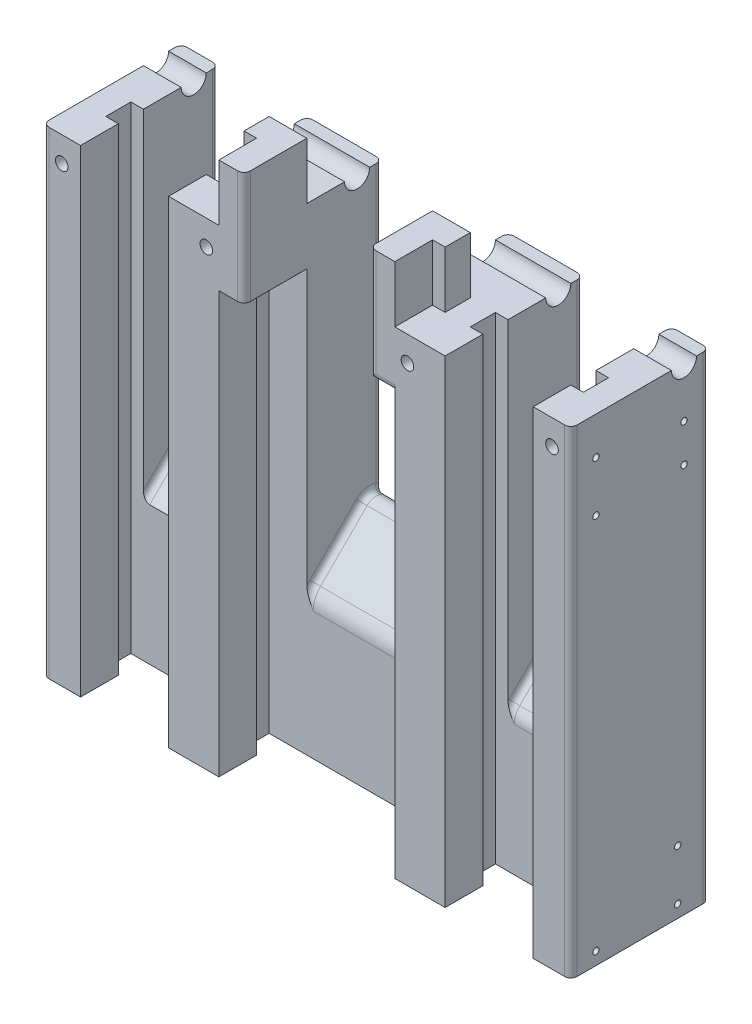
SolidWorks part; units mm, degrees
ref_plane "Front Plane" through (0, 0, 0) normal (0, 0, 1) x (1, 0, 0)
ref_plane "Top Plane" through (0, 0, 0) normal (0, 1, 0) x (1, 0, 0)
ref_plane "Right Plane" through (0, 0, 0) normal (1, 0, 0) x (0, 0, -1)
sketch "Sketch1" plane through (0, 0, 0) normal (0, 0, 1) x (1, 0, 0)
  line L5 (533.4, 406.4) -> (0, 406.4)
  line L7 (533.4, 406.4) -> (533.4, 533.4)
  line L8 (533.4, 533.4) -> (0, 533.4)
  line L9 (0, 406.4) -> (0, 533.4)
  line L10 (0, 406.4) -> (0, 0)
  line L16 (533.4, 406.4) -> (533.4, 0)
  line L17 (533.4, 406.4) -> (0, 533.4) construction
  line L18 (533.4, 0) -> (0, 0)
  line L19 (533.4, 533.4) -> (0, 406.4) construction
  line L24 (0, 406.4) -> (533.4, 406.4)
  point P2 (266.7, 469.9)
  dimension "D1" = 406.4
  dimension "D2" = 533.4
  dimension "D3" = 127
extrude "Boss-Extrude1" add sketch "Sketch1" along normal blind 139.7 contours L24 L10 L18 L16 | L9 L5 L7 L8
sketch "Sketch3" plane through (0, 533.4, 0) normal (0, 1, 0) x (1, 0, 0)
  line L0 (127, -101.6) -> (139.7, -101.6)
  line L1 (406.4, -101.6) -> (393.7, -101.6)
  line L2 (0, -139.7) -> (0, 0) construction
  line L3 (355.6, -101.6) -> (368.3, -101.6)
  line L6 (355.6, -155.448) -> (177.8, -155.448)
  line L8 (533.4, 0) -> (0, 0) construction
  line L10 (495.3, -155.448) -> (406.4, -155.448)
  line L11 (495.3, -155.448) -> (495.3, -101.6)
  line L13 (406.4, -155.448) -> (406.4, -101.6)
  line L15 (38.1, -155.448) -> (127, -155.448)
  line L16 (38.1, -155.448) -> (38.1, -101.6)
  line L17 (127, -155.448) -> (127, -101.6)
  line L18 (533.4, -76.2) -> (0, -76.2) construction
  line L23 (139.7, -76.2) -> (139.7, -101.6)
  line L24 (508, -76.2) -> (393.7, -76.2)
  line L25 (508, -76.2) -> (508, -101.6)
  line L26 (508, -101.6) -> (495.3, -101.6)
  line L27 (393.7, -76.2) -> (393.7, -101.6)
  line L28 (266.7, -76.2) -> (266.7, 0) construction
  line L29 (177.8, -101.6) -> (177.8, -155.448)
  line L30 (165.1, -76.2) -> (368.3, -76.2)
  line L31 (165.1, -76.2) -> (165.1, -101.6)
  line L32 (165.1, -101.6) -> (177.8, -101.6)
  line L33 (368.3, -76.2) -> (368.3, -101.6)
  line L36 (25.4, -101.6) -> (38.1, -101.6)
  line L37 (25.4, -76.2) -> (25.4, -101.6)
  line L38 (25.4, -76.2) -> (139.7, -76.2)
  line L39 (355.6, -101.6) -> (355.6, -155.448)
  dimension "D1" = 25.4
  dimension "D2" = 38.1
  dimension "D3" = 127
  dimension "D4" = 165.1
  dimension "D5" = 266.7
  dimension "D6" = 393.7
  dimension "D7" = 76.2
  dimension "D8" = 101.6
  dimension "D9" = 155.448
extrude "Cut-Extrude1" cut sketch "Sketch3" against normal through all both and the other way through all
sketch "Sketch4" plane through (0, 533.4, 0) normal (0, 1, 0) x (1, 0, 0)
  line L0 (266.7, -104.648) -> (266.7, 0)
  line L3 (127, -101.6) -> (127, -139.7) construction
  line L4 (177.8, -139.7) -> (127, -139.7) construction
  line L5 (203.2, -104.648) -> (330.2, -104.648)
  line L6 (203.2, -104.648) -> (203.2, 0)
  line L7 (203.2, 0) -> (330.2, 0)
  line L8 (330.2, -104.648) -> (330.2, 0)
  line L9 (203.2, -104.648) -> (330.2, 0) construction
  line L10 (203.2, 0) -> (330.2, -104.648) construction
  point P8 (266.7, -52.324)
  dimension "D1" = 76.2
  dimension "D2" = 139.7
  dimension "D3" = 35.052
  dimension "D4" = 87.376
extrude "Cut-Extrude2" cut sketch "Sketch4" against normal blind 292.1
sketch "Sketch5" plane through (0, 533.4, 0) normal (0, 1, 0) x (1, 0, 0)
  line L0 (82.55, -101.6) -> (82.55, 0)
  line L3 (266.7, 0) -> (266.7, -76.2)
  line L4 (38.1, -101.6) -> (127, -101.6)
  line L5 (38.1, -101.6) -> (38.1, 0)
  line L6 (38.1, 0) -> (127, 0)
  line L7 (127, -101.6) -> (127, 0)
  line L8 (38.1, -101.6) -> (127, 0) construction
  line L9 (38.1, 0) -> (127, -101.6) construction
  line L12 (495.3, 0) -> (406.4, -101.6) construction
  line L13 (495.3, -101.6) -> (406.4, 0) construction
  line L14 (406.4, -101.6) -> (406.4, 0)
  line L15 (495.3, 0) -> (406.4, 0)
  line L16 (495.3, -101.6) -> (495.3, 0)
  line L17 (495.3, -101.6) -> (406.4, -101.6)
  line L18 (450.85, -101.6) -> (450.85, 0)
  line L19 (406.4, -139.7) -> (406.4, -101.6) construction
  line L20 (406.4, -139.7) -> (406.4, -101.6) construction
  point P6 (82.55, -50.8)
  point P23 (450.85, -50.8)
  dimension "D1" = 82.55
  dimension "D2" = 127
  dimension "D4" = 266.7
  dimension "D5" = 50.8
  dimension "D6" = 76.2
extrude "Cut-Extrude3" cut sketch "Sketch5" against normal blind 292.1
sketch "Sketch7" plane through (533.4, 0, 0) normal (1, 0, 0) x (0, 0, -1)
  line L3 (0, 533.4) -> (0, 0) construction
  line L4 (-139.7, 533.4) -> (0, 533.4) construction
  circle A0 centre (-25.4, 508) radius 12.7
  dimension "D1" = 25.4
  dimension "D2" = 25.4
  dimension "D3" = 25.4
extrude "Cut-Extrude4" cut sketch "Sketch7" against normal through all
chamfer "Chamfer1" distance 76.2 angle 45 3 edges at (82.55, 241.3, 76.2) (450.85, 241.3, 76.2) (266.7, 241.3, 76.2)
fillet "Fillet1" radius 12.7 3 edges at (82.55, 241.3, 0) (266.7, 241.3, 0) (450.85, 241.3, 0)
fillet "Fillet2" radius 19.05 1 edges at (450.85, 165.1, 76.2)
fillet "Fillet3" radius 25.4 1 edges at (266.7, 165.1, 76.2)
sketch "Sketch8" plane through (0, 533.4, 0) normal (0, 1, 0) x (1, 0, 0)
  line L0 (533.4, 0) -> (495.3, 0) construction
  line L1 (495.3, 0) -> (495.3, -76.2) construction
  line L2 (495.3, -76.2) -> (508, -76.2) construction
  line L3 (508, -76.2) -> (508, -101.6) construction
  line L4 (508, -101.6) -> (495.3, -101.6) construction
  line L5 (495.3, -101.6) -> (495.3, -139.7) construction
  line L6 (495.3, -139.7) -> (533.4, -139.7) construction
  line L7 (533.4, -139.7) -> (533.4, 0) construction
  line L8 (38.1, -76.2) -> (38.1, 0) construction
  line L9 (38.1, 0) -> (0, 0) construction
  line L10 (0, 0) -> (0, -139.7) construction
  line L11 (0, -139.7) -> (38.1, -139.7) construction
  line L12 (38.1, -139.7) -> (38.1, -101.6) construction
  line L13 (38.1, -101.6) -> (25.4, -101.6) construction
  line L14 (25.4, -101.6) -> (25.4, -76.2) construction
  line L15 (25.4, -76.2) -> (38.1, -76.2) construction
  line L16 (203.2, 0) -> (127, 0) construction
  line L17 (127, 0) -> (127, -76.2) construction
  line L18 (127, -76.2) -> (139.7, -76.2) construction
  line L19 (139.7, -76.2) -> (139.7, -101.6) construction
  line L20 (139.7, -101.6) -> (127, -101.6) construction
  line L21 (127, -101.6) -> (127, -139.7) construction
  line L22 (127, -139.7) -> (177.8, -139.7) construction
  line L23 (177.8, -139.7) -> (177.8, -101.6) construction
  line L24 (177.8, -101.6) -> (165.1, -101.6) construction
  line L25 (165.1, -101.6) -> (165.1, -76.2) construction
  line L26 (165.1, -76.2) -> (203.2, -76.2) construction
  line L27 (203.2, -76.2) -> (203.2, 0) construction
  line L28 (406.4, -76.2) -> (406.4, 0) construction
  line L29 (406.4, 0) -> (330.2, 0) construction
  line L30 (330.2, 0) -> (330.2, -76.2) construction
  line L31 (330.2, -76.2) -> (368.3, -76.2) construction
  line L32 (368.3, -76.2) -> (368.3, -101.6) construction
  line L33 (368.3, -101.6) -> (355.6, -101.6) construction
  line L34 (355.6, -101.6) -> (355.6, -139.7) construction
  line L35 (355.6, -139.7) -> (406.4, -139.7) construction
  line L36 (406.4, -139.7) -> (406.4, -101.6) construction
  line L37 (406.4, -101.6) -> (393.7, -101.6) construction
  line L38 (393.7, -101.6) -> (393.7, -76.2) construction
  line L39 (393.7, -76.2) -> (406.4, -76.2) construction
  line L40 (533.4, 0) -> (495.3, 0)
  line L41 (495.3, 0) -> (495.3, -76.2)
  line L42 (495.3, -76.2) -> (508, -76.2)
  line L43 (508, -76.2) -> (508, -101.6)
  line L44 (508, -101.6) -> (495.3, -101.6)
  line L45 (495.3, -101.6) -> (495.3, -139.7)
  line L46 (495.3, -139.7) -> (533.4, -139.7)
  line L47 (533.4, -139.7) -> (533.4, 0)
  line L48 (38.1, -76.2) -> (38.1, 0)
  line L49 (38.1, 0) -> (0, 0)
  line L50 (0, 0) -> (0, -139.7)
  line L51 (0, -139.7) -> (38.1, -139.7)
  line L52 (38.1, -139.7) -> (38.1, -101.6)
  line L53 (38.1, -101.6) -> (25.4, -101.6)
  line L54 (25.4, -101.6) -> (25.4, -76.2)
  line L55 (25.4, -76.2) -> (38.1, -76.2)
  line L56 (203.2, 0) -> (127, 0)
  line L57 (127, 0) -> (127, -76.2)
  line L58 (127, -76.2) -> (139.7, -76.2)
  line L59 (139.7, -76.2) -> (139.7, -101.6)
  line L60 (139.7, -101.6) -> (127, -101.6)
  line L61 (127, -101.6) -> (127, -139.7)
  line L62 (127, -139.7) -> (177.8, -139.7)
  line L63 (177.8, -139.7) -> (177.8, -101.6)
  line L64 (177.8, -101.6) -> (165.1, -101.6)
  line L65 (165.1, -101.6) -> (165.1, -76.2)
  line L66 (165.1, -76.2) -> (203.2, -76.2)
  line L67 (203.2, -76.2) -> (203.2, 0)
  line L68 (406.4, -76.2) -> (406.4, 0)
  line L69 (406.4, 0) -> (330.2, 0)
  line L70 (330.2, 0) -> (330.2, -76.2)
  line L71 (330.2, -76.2) -> (368.3, -76.2)
  line L72 (368.3, -76.2) -> (368.3, -101.6)
  line L73 (368.3, -101.6) -> (355.6, -101.6)
  line L74 (355.6, -101.6) -> (355.6, -139.7)
  line L75 (355.6, -139.7) -> (406.4, -139.7)
  line L76 (406.4, -139.7) -> (406.4, -101.6)
  line L77 (406.4, -101.6) -> (393.7, -101.6)
  line L78 (393.7, -101.6) -> (393.7, -76.2)
  line L79 (393.7, -76.2) -> (406.4, -76.2)
extrude "Boss-Extrude3" add sketch "Sketch8" along normal blind 127
sketch "Sketch9" plane through (0, 660.4, 0) normal (0, 1, 0) x (1, 0, 0)
  line L1 (0, 0) -> (533.4, 0)
  line L2 (0, 0) -> (0, -139.7)
  line L3 (0, -139.7) -> (533.4, -139.7)
  line L4 (533.4, 0) -> (533.4, -139.7)
  line L5 (0, 0) -> (533.4, -139.7) construction
  line L6 (0, -139.7) -> (533.4, 0) construction
  point P4 (266.7, -69.85)
extrude "Boss-Extrude4" add sketch "Sketch9" along normal blind 25.4
sketch "Sketch11" plane through (533.4, 0, 0) normal (1, 0, 0) x (0, 0, -1)
  line L0 (0, 508) -> (-139.7, 508)
  line L1 (0, 685.8) -> (0, 0) construction
  line L2 (-139.7, 685.8) -> (-139.7, 0) construction
  line L7 (0, 0) -> (0, 685.8)
  line L8 (0, 685.8) -> (-139.7, 685.8)
  line L9 (-139.7, 685.8) -> (-139.7, 0)
  line L10 (-139.7, 0) -> (0, 0)
  line L11 (0, 0) -> (0, 685.8)
  line L12 (0, 685.8) -> (-139.7, 685.8)
  line L13 (-139.7, 685.8) -> (-139.7, 0)
  line L14 (-139.7, 0) -> (0, 0)
  dimension "D1" = 0
extrude "Cut-Extrude5" cut sketch "Sketch11" against normal through all contours L0 M7 M8 M9 M6
sketch "Sketch12" plane through (0, 0, 139.7) normal (0, 0, 1) x (1, 0, 0)
  line L0 (0, 508) -> (38.1, 508) construction
  line L1 (38.1, 508) -> (38.1, 0) construction
  line L2 (127, 0) -> (127, 508) construction
  line L3 (127, 508) -> (177.8, 508) construction
  line L4 (177.8, 508) -> (355.6, 508)
  line L5 (355.6, 508) -> (406.4, 508) construction
  line L6 (266.7, 508) -> (266.7, 532.3356)
  circle A0 centre (19.05, 482.6) radius 6.35
  circle A1 centre (165.1, 482.6) radius 6.35
  circle A2 centre (514.35, 482.6) radius 6.35
  circle A3 centre (368.3, 482.6) radius 6.35
  dimension "D1" = 12.7
  dimension "D2" = 25.4
  dimension "D3" = 19.05
  dimension "D4" = 38.1
  dimension "D5" = 12.7
  dimension "D6" = 25.4
sketch "Sketch13" plane through (0, 508, 0) normal (0, 1, 0) x (1, 0, 0)
  line L0 (203.2, -38.1) -> (203.2, -76.2) construction
  line L1 (165.1, -76.2) -> (203.2, -76.2)
  line L2 (165.1, -76.2) -> (165.1, -139.7)
  line L3 (165.1, -139.7) -> (203.2, -139.7)
  line L4 (203.2, -76.2) -> (203.2, -139.7)
  line L5 (165.1, -76.2) -> (203.2, -139.7) construction
  line L6 (165.1, -139.7) -> (203.2, -76.2) construction
  line L7 (127, -38.1) -> (203.2, -38.1) construction
  line L30 (177.8, -139.7) -> (177.8, -101.6)
  line L31 (177.8, -101.6) -> (165.1, -101.6)
  line L32 (165.1, -101.6) -> (165.1, -76.2)
  line L33 (165.1, -76.2) -> (203.2, -76.2)
  line L34 (203.2, -76.2) -> (203.2, -38.1)
  line L35 (203.2, -38.1) -> (127, -38.1)
  line L36 (127, -38.1) -> (127, -76.2)
  line L37 (127, -76.2) -> (139.7, -76.2)
  line L38 (139.7, -76.2) -> (139.7, -101.6)
  line L39 (139.7, -101.6) -> (127, -101.6)
  line L40 (127, -101.6) -> (127, -139.7)
  line L41 (127, -139.7) -> (177.8, -139.7)
  point P4 (184.15, -107.95)
  dimension "D1" = 19.05
  dimension "D2" = 25.4
  dimension "D3" = 63.5
  dimension "D4" = 63.5
extrude "Boss-Extrude5" add sketch "Sketch13" along normal mid plane 114.3 contours L4 L3 M20 M19 M18 M17
ref_plane "Plane1" through (266.7, 0, 0) normal (1, 0, 0) x (0, 0, -1)
mirror "Mirror1" about plane through (266.7, 0, 0) normal (1, 0, 0) of "Boss-Extrude5"
ref_plane "Plane2" through (0, 0, 69.85) normal (0, 0, 1) x (1, 0, 0)
fillet "Fillet4" radius 6.35 12 edges at (0, 254, 0) (0, 254, 139.7) (533.4, 254, 0) (533.4, 254, 139.7) (127, 359.3197, 0) (38.1, 359.3197, 0) (495.3, 359.3197, 0) (330.2, 359.3197, 0) (203.2, 359.3197, 0) (342.9, 450.85, 139.7) (203.2, 508, 139.7) (330.2, 508, 139.7)
fillet "Fillet7" radius 6.35 22 edges at (497.379, 216.9012, 1.651) (495.3, 223.2308, 14.3577) (495.3, 164.4994, 74.7499) (406.4, 164.4994, 74.7499) (406.4, 222.3728, 7.8399) (36.021, 216.9012, 1.651) (38.1, 223.2308, 14.3577) (129.079, 216.9012, 1.651) (127, 223.2308, 14.3577) (203.2, 164.2991, 74.2665) (201.121, 216.9012, 1.651) (203.2, 223.2308, 14.3577) (332.279, 216.9012, 1.651) (330.2, 223.2308, 14.3577) (330.2, 164.2991, 74.2665) (406.4, 359.3197, 0) (495.3, 195.1497, 46.1503) (406.4, 195.1497, 46.1503) (38.1, 192.3599, 48.9401) (127, 192.3599, 48.9401) (203.2, 196.0796, 45.2204) (330.2, 196.0796, 45.2204)
sketch "Sketch14" plane through (533.4, 0, 0) normal (1, 0, 0) x (0, 0, -1)
sketch "Sketch15" plane through (0, 0, 0) normal (-1, 0, 0) x (0, 0, 1)
  line L0 (38.1, 508) -> (133.35, 508) construction
  line L1 (133.35, 0) -> (133.35, 508) construction
  line L2 (6.35, 508) -> (12.7, 508) construction
  line L3 (25.4, 508) -> (25.4, 395.0891)
  line L4 (6.35, 508) -> (6.35, 0) construction
  line L5 (133.35, 0) -> (6.35, 0) construction
  line L6 (114.3, 38.1) -> (31.75, 38.1)
  line L7 (31.75, 38.1) -> (31.75, 88.9)
  circle A0 centre (25.4, 457.2) radius 3.175
  circle A1 centre (114.3, 469.9) radius 3.175
  circle A2 centre (25.4, 419.1) radius 3.175
  circle A3 centre (114.3, 419.1) radius 3.175
  circle A4 centre (31.75, 88.9) radius 3.175
  circle A5 centre (114.3, 38.1) radius 3.175
  circle A6 centre (31.75, 38.1) radius 3.175
  dimension "D1" = 6.35
  dimension "D2" = 38.1
  dimension "D3" = 38.1
  dimension "D4" = 19.05
  dimension "D5" = 50.8
  dimension "D6" = 19.05
  dimension "D7" = 50.8
  dimension "D8" = 25.4
  dimension "D9" = 19.05
  dimension "D10" = 38.1
  dimension "D11" = 6.35
  dimension "D12" = 88.9
extrude "Cut-Extrude6" cut sketch "Sketch15" against normal blind 25.4
mirror "Mirror2" about plane through (266.7, 0, 0) normal (1, 0, 0) of "Cut-Extrude6"
extrude "Cut-Extrude7" cut sketch "Sketch12" against normal blind 25.4 contours A1 | A3 | A0 | A2
mirror "Mirror3" about plane through (0, 0, 69.85) normal (0, 0, 1) of "Cut-Extrude7"
sketch "Sketch16" plane through (0, 0, 0) normal (0, -1, 0) x (1, 0, 0)
  line L28 (0, 133.35) -> (0, 6.35)
  line L29 (6.35, 0) -> (527.05, 0)
  line L30 (533.4, 6.35) -> (533.4, 133.35)
  line L31 (527.05, 139.7) -> (495.3, 139.7)
  line L32 (495.3, 139.7) -> (495.3, 101.6)
  line L33 (495.3, 101.6) -> (508, 101.6)
  line L34 (508, 101.6) -> (508, 76.2)
  line L35 (508, 76.2) -> (393.7, 76.2)
  line L36 (393.7, 76.2) -> (393.7, 101.6)
  line L37 (393.7, 101.6) -> (406.4, 101.6)
  line L38 (406.4, 101.6) -> (406.4, 139.7)
  line L39 (406.4, 139.7) -> (355.6, 139.7)
  line L40 (355.6, 139.7) -> (355.6, 101.6)
  line L41 (355.6, 101.6) -> (368.3, 101.6)
  line L42 (368.3, 101.6) -> (368.3, 76.2)
  line L43 (368.3, 76.2) -> (165.1, 76.2)
  line L44 (165.1, 76.2) -> (165.1, 101.6)
  line L45 (165.1, 101.6) -> (177.8, 101.6)
  line L46 (177.8, 101.6) -> (177.8, 139.7)
  line L47 (177.8, 139.7) -> (127, 139.7)
  line L48 (127, 139.7) -> (127, 101.6)
  line L49 (127, 101.6) -> (139.7, 101.6)
  line L50 (139.7, 101.6) -> (139.7, 76.2)
  line L51 (139.7, 76.2) -> (25.4, 76.2)
  line L52 (25.4, 76.2) -> (25.4, 101.6)
  line L53 (25.4, 101.6) -> (38.1, 101.6)
  line L54 (38.1, 101.6) -> (38.1, 139.7)
  line L55 (38.1, 139.7) -> (6.35, 139.7)
  line L56 (0, 133.35) -> (0, 6.35)
  line L57 (6.35, 0) -> (527.05, 0)
  line L58 (533.4, 6.35) -> (533.4, 133.35)
  line L59 (527.05, 139.7) -> (495.3, 139.7)
  line L60 (495.3, 139.7) -> (495.3, 101.6)
  line L61 (495.3, 101.6) -> (508, 101.6)
  line L62 (508, 101.6) -> (508, 76.2)
  line L63 (508, 76.2) -> (393.7, 76.2)
  line L64 (393.7, 76.2) -> (393.7, 101.6)
  line L65 (393.7, 101.6) -> (406.4, 101.6)
  line L66 (406.4, 101.6) -> (406.4, 139.7)
  line L67 (406.4, 139.7) -> (355.6, 139.7)
  line L68 (355.6, 139.7) -> (355.6, 101.6)
  line L69 (355.6, 101.6) -> (368.3, 101.6)
  line L70 (368.3, 101.6) -> (368.3, 76.2)
  line L71 (368.3, 76.2) -> (165.1, 76.2)
  line L72 (165.1, 76.2) -> (165.1, 101.6)
  line L73 (165.1, 101.6) -> (177.8, 101.6)
  line L74 (177.8, 101.6) -> (177.8, 139.7)
  line L75 (177.8, 139.7) -> (127, 139.7)
  line L76 (127, 139.7) -> (127, 101.6)
  line L77 (127, 101.6) -> (139.7, 101.6)
  line L78 (139.7, 101.6) -> (139.7, 76.2)
  line L79 (139.7, 76.2) -> (25.4, 76.2)
  line L80 (25.4, 76.2) -> (25.4, 101.6)
  line L81 (25.4, 101.6) -> (38.1, 101.6)
  line L82 (38.1, 101.6) -> (38.1, 139.7)
  line L83 (38.1, 139.7) -> (6.35, 139.7)
  arc A4 (0, 6.35) -> (6.35, 0) centre (6.35, 6.35) ccw
  arc A5 (527.05, 0) -> (533.4, 6.35) centre (527.05, 6.35) ccw
  arc A6 (533.4, 133.35) -> (527.05, 139.7) centre (527.05, 133.35) ccw
  arc A7 (6.35, 139.7) -> (0, 133.35) centre (6.35, 133.35) ccw
  arc A8 (0, 6.35) -> (6.35, 0) centre (6.35, 6.35) ccw
  arc A9 (527.05, 0) -> (533.4, 6.35) centre (527.05, 6.35) ccw
  arc A10 (533.4, 133.35) -> (527.05, 139.7) centre (527.05, 133.35) ccw
  arc A11 (6.35, 139.7) -> (0, 133.35) centre (6.35, 133.35) ccw
  dimension "D1" = 0
extrude "Cut-Extrude8" cut sketch "Sketch16" against normal blind 25.4
